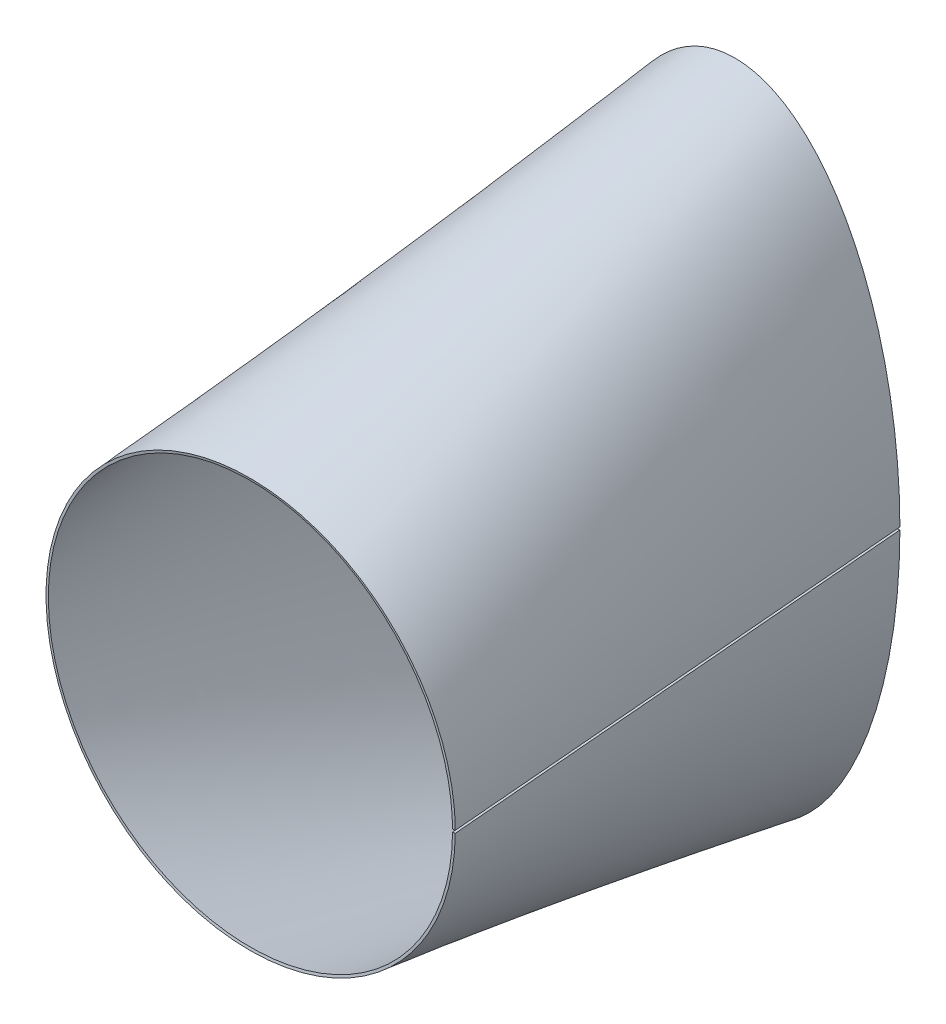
SolidWorks part; units mm, degrees
ref_plane "Front" through (0, 0, 0) normal (0, 0, 1) x (1, 0, 0)
ref_plane "Top" through (0, 0, 0) normal (0, 1, 0) x (1, 0, 0)
ref_plane "Right" through (0, 0, 0) normal (1, 0, 0) x (0, 0, -1)
sketch "ClipBoard" plane through (0, 0, 0) normal (1, 0, 0) x (0, 0, -1)
  line L0 (0, 0) -> (175.6029, 102.2442) construction
  line L1 (0, 0) -> (-1.0976, 1.147) construction
  line L2 (0, 0) -> (1.5592, -0.2986) construction
  line L3 (0, 0) -> (-320.261, -250.1876) construction
sketch "Inlet" plane through (0, 0, 0) normal (0, 0, 1) x (1, 0, 0)
  line L0 (0, 0) -> (94.7781, 0) construction
  line L1 (0, -0.7937) -> (126.5792, -0.7937) construction
  line L2 (0, 0.7937) -> (126.5792, 0.7937) construction
  ellipse E0 centre (0, 0) end of major axis (0, 203.2) minor radius 101.6 (101.5992, 0.7938) -> (101.5992, -0.7937) ccw
ref_plane "ExitPlane" through (0, 0, 304.8) normal (0, 0, 1) x (1, 0, 0)
sketch "Outlet" plane through (0, 0, 304.8) normal (0, 0, 1) x (1, 0, 0)
  line L0 (0, 0.7937) -> (126.5792, 0.7937) construction
  line L1 (0, -0.7937) -> (126.5792, -0.7937) construction
  line L2 (0, 0.7937) -> (141.5766, 0.7937) construction
  line L3 (0, -0.7937) -> (144.4813, -0.7937) construction
  arc A0 (126.9975, 0.7937) -> (126.9975, -0.7937) centre (0, 0) ccw
  dimension "Diameter" = 254
sheet metal parameters "Sheet-Metal1" thickness 1.5875 parameters "D1"=0.7366
lofted bend "Transition" parameters "D1"=0, "D12"=1
other "Freeform Bend1" parameters "D1"=1000, "D4"=57.296, "D5"=1
flat pattern "Flat-Pattern1"
sketch "Bend-Lines1" plane through (0, 0, 0) normal (0, 1, 0) x (-1, 0, 0)
other "Flatten-<Freeform Bend1>1"
equation "\"Gap@ClipBoard\" = \"Thickness@ClipBoard\" * 1.0"
equation "\"HalfMinorAxis@Inlet\" = \"MinorAxis@ClipBoard\" / 2"
equation "\"HalfMajorAxis@Inlet\" = \"MajorAxis@ClipBoard\" / 2"
equation "\"HalfGap@Inlet\" = \"Gap@ClipBoard\" / 2"
